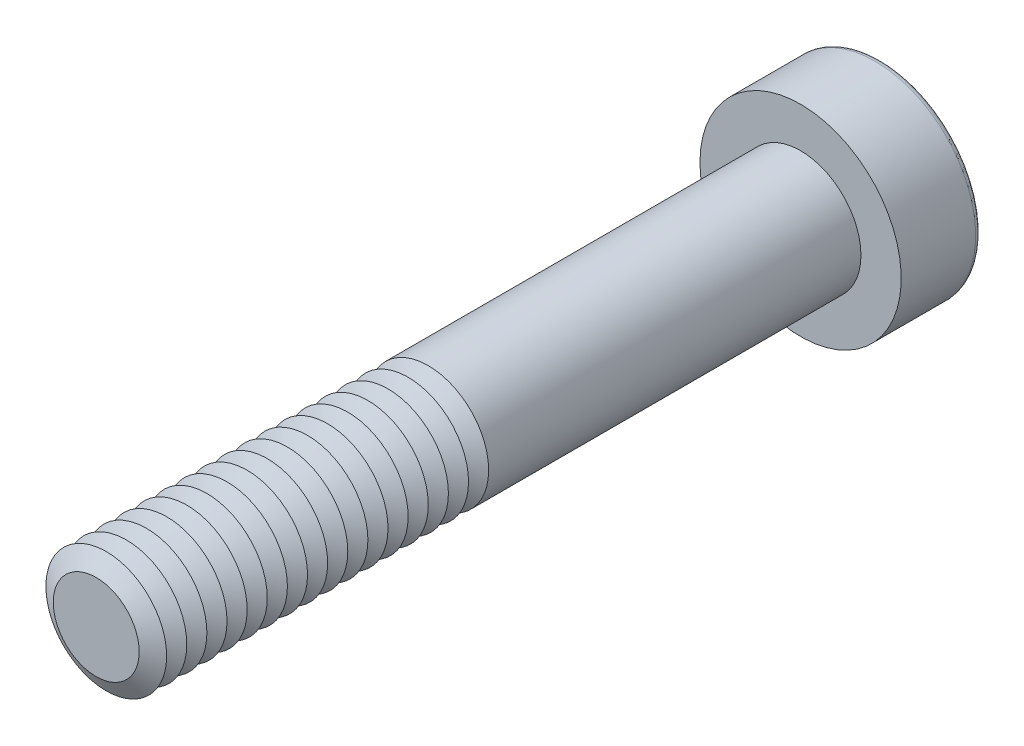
SolidWorks part; units mm, degrees
ref_plane "Front Plane" through (0, 0, 0) normal (0, 0, 1) x (1, 0, 0)
ref_plane "Top Plane" through (0, 0, 0) normal (0, 1, 0) x (1, 0, 0)
ref_plane "Right Plane" through (0, 0, 0) normal (1, 0, 0) x (0, 0, -1)
sketch "Sketch1" plane through (0, 0, 0) normal (0, 0, 1) x (1, 0, 0)
  circle A0 centre (0, 0) radius 3
  dimension "D1" = 6
extrude "Boss-Extrude1" add sketch "Sketch1" along normal blind 35
sketch "Sketch2" plane through (0, 0, 0) normal (0, 0, -1) x (-1, 0, 0)
  circle A0 centre (0, 0) radius 5
  dimension "D1" = 10
extrude "Boss-Extrude2" add sketch "Sketch2" along normal blind 4
sketch "Sketch3" plane through (0, 0, -4) normal (0, 0, -1) x (-1, 0, 0)
  line L1 (-1.1547, 2) -> (-2.3094, 0)
  line L2 (-2.3094, 0) -> (-1.1547, -2)
  line L3 (-1.1547, -2) -> (1.1547, -2)
  line L4 (1.1547, -2) -> (2.3094, 0)
  line L5 (2.3094, 0) -> (1.1547, 2)
  line L6 (1.1547, 2) -> (-1.1547, 2)
  circle A0 centre (0, 0) radius 2 construction
  dimension "D1" = 4
extrude "Cut-Extrude1" cut sketch "Sketch3" against normal blind 3
fillet "Fillet1" radius 0.3 1 edges at (-5, 0, -4)
sketch "Sketch4" plane through (0, 0, -1) normal (0, 0, -1) x (-1, 0, 0)
  line L0 (1.1547, -2) -> (2.3094, 0) construction
  circle A0 centre (0, 0) radius 2
extrude "Cut-Extrude2" cut sketch "Sketch4" against normal through all draft 60
sketch "Sketch5" plane through (0, 0, -4) normal (0, 0, -1) x (-1, 0, 0)
  circle A0 centre (0, 0) radius 2.3094
extrude "Cut-Extrude3" cut sketch "Sketch5" against normal through all draft 75
sketch "Sketch7" plane through (0, 0, 0) normal (1, 0, 0) x (0, 0, -1)
  line L25 (-35, 2.134) -> (-34.5, 3)
  line L26 (-35, 3) -> (-35, -3) construction
  line L27 (-34.5, 3) -> (-35.5, 3)
  line L28 (-35.5, 3) -> (-35, 2.134)
  line L29 (0, 3) -> (-35, 3) construction
  dimension "D1" = 1
revolve "Cut-Revolve1" cut sketch "Sketch7" angle 360 about axis through (0, 0, 35) along (0, 0, -1)
pattern_linear "LPattern1" count 17 spacing 1 along (0, 0, -1) of "Cut-Revolve1"
